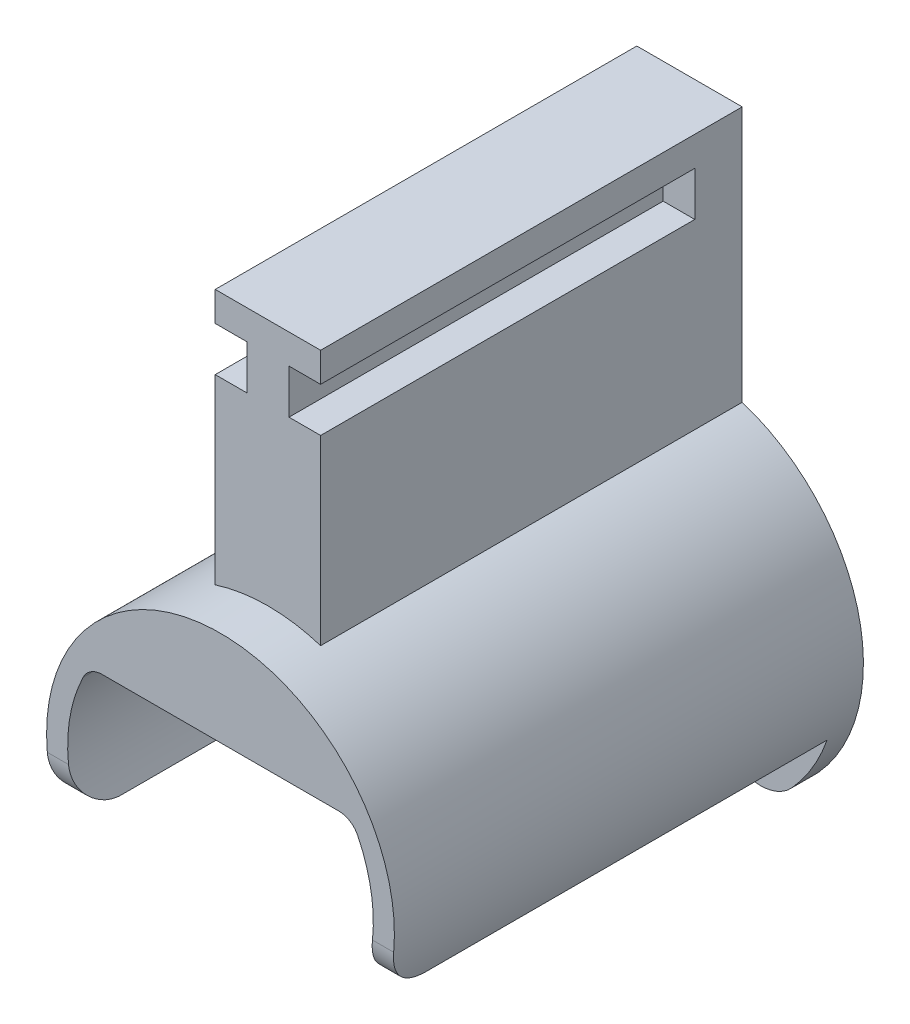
SolidWorks part; units mm, degrees
ref_plane "Front Plane" through (0, 0, 0) normal (0, 0, 1) x (1, 0, 0)
ref_plane "Top Plane" through (0, 0, 0) normal (0, 1, 0) x (1, 0, 0)
ref_plane "Right Plane" through (0, 0, 0) normal (1, 0, 0) x (0, 0, -1)
sketch "Sketch2" plane through (0, 0, 0) normal (0, 0, 1) x (1, 0, 0)
  circle A0 centre (0, 0) radius 5.25
  circle A1 centre (0, 0) radius 16.5
  dimension "D1" = 33
  dimension "D2" = 10.5
extrude "Boss-Extrude1" add sketch "Sketch2" along normal blind 2.5
sketch "Sketch3" plane through (0, 0, 2.5) normal (0, 0, 1) x (1, 0, 0)
  circle A0 centre (0, 0) radius 16.5
  circle A1 centre (0, 0) radius 14.5
  circle A2 centre (0, 0) radius 16.5 construction
  dimension "D1" = 2
extrude "Boss-Extrude2" add sketch "Sketch3" along normal blind 42
sketch "Sketch4" plane through (0, 0, 44.5) normal (0, 0, 1) x (1, 0, 0)
  line L0 (-14.6969, 7.5) -> (14.6969, 7.5)
  line L1 (0, 16.5) -> (17.7782, 16.5) construction
  circle A0 centre (0, 0) radius 16.5 construction
  arc A1 (14.6969, 7.5) -> (-14.6969, 7.5) centre (0, 0) ccw
  dimension "D1" = 9
extrude "Boss-Extrude3" add sketch "Sketch4" against normal blind 2.5
sketch "Sketch5" plane through (0, 0, 44.5) normal (0, 0, 1) x (1, 0, 0)
  line L0 (-15.5563, -5.5) -> (15.5563, -5.5)
  line L1 (0, -16.5) -> (-16.9039, -16.5) construction
  circle A0 centre (0, 0) radius 16.5 construction
  arc A1 (-15.5563, -5.5) -> (15.5563, -5.5) centre (0, 0) ccw
  dimension "D1" = 11
extrude "Cut-Extrude1" cut sketch "Sketch5" against normal up to surface (42 mm away)
sketch "Sketch6" plane through (0, 0, 2.5) normal (0, 0, 1) x (1, 0, 0)
  line L0 (-5.25, 0) -> (-5.25, -15.6425)
  line L1 (5.25, 0) -> (5.25, -15.6425)
  line L2 (-5.25, 0) -> (5.25, 0) construction
  circle A0 centre (0, 0) radius 5.25 construction
  arc A1 (-15.5563, -5.5) -> (15.5563, -5.5) centre (0, 0) ccw construction
  arc A2 (-5.25, 0) -> (5.25, 0) centre (0, 0) ccw
  arc A3 (-5.25, -15.6425) -> (5.25, -15.6425) centre (0, 0) ccw
extrude "Cut-Extrude2" cut sketch "Sketch6" against normal up to next
fillet "Fillet1" radius 4 4 edges at (14.4864, -5.5, 44.5) (-14.4864, -5.5, 44.5) (-5.25, -15.6425, 1.25) (5.25, -15.6425, 1.25)
fillet "Fillet2" radius 2 2 edges at (-12.4097, 7.5, 43.25) (12.4097, 7.5, 43.25)
fillet "Fillet3" radius 1 1 edges at (0, 14.5, 2.5)
sketch "Sketch7" plane through (0, 0, 0) normal (0, 0, 1) x (1, 0, 0)
  line L0 (0, 0) -> (0, 25.5396) construction
  line L1 (-5, 40) -> (5, 40)
  line L2 (-5, 40) -> (-5, 15.7242)
  line L3 (5, 40) -> (5, 15.7242)
  arc A0 (16.4317, -1.5) -> (-16.4317, -1.5) centre (0, 0) ccw construction
  arc A1 (5, 15.7242) -> (-5, 15.7242) centre (0, 0) ccw
  dimension "D1" = 10
  dimension "D2" = 40
extrude "Boss-Extrude4" add sketch "Sketch7" along normal up to surface (44.5 mm away)
sketch "Sketch9" plane through (-5, 0, 0) normal (-1, 0, 0) x (0, 0, 1)
  line L0 (44.5, 40) -> (0, 40) construction
  line L1 (44.5, 40) -> (44.5, 15.7242) construction
  line L3 (4.5, 37.2) -> (44.5, 37.2)
  line L4 (4.5, 37.2) -> (4.5, 33)
  line L5 (4.5, 33) -> (44.5, 33)
  line L6 (44.5, 37.2) -> (44.5, 33)
  dimension "D1" = 4.2
  dimension "D2" = 40
  dimension "D3" = 2.8
extrude "Cut-Extrude3" cut sketch "Sketch9" against normal blind 3
mirror "Mirror1" about plane through (0, 0, 0) normal (1, 0, 0) of "Cut-Extrude3"
sketch "Sketch10" plane through (0, 0, 44.5) normal (0, 0, 1) x (1, 0, 0)
  line L1 (-5, 40) -> (5, 40)
  line L2 (-5, 40) -> (-5, 15.7242)
  line L4 (5, 40) -> (5, 15.7242)
  arc A0 (5, 15.7242) -> (-5, 15.7242) centre (0, 0) ccw
extrude "Cut-Extrude4" cut sketch "Sketch10" against normal blind 4.5
sketch "Sketch11" plane through (0, 0, 0) normal (0, 0, -1) x (-1, 0, 0)
  line L0 (-24.8106, 0) -> (27.5243, 0) construction
  line L1 (0, 14.8041) -> (0, -13.573) construction
  circle A0 centre (-8, 0) radius 1.5
  circle A1 centre (8, 0) radius 1.5
  dimension "D1" = 3
  dimension "D2" = 8
extrude "Cut-Extrude5" cut sketch "Sketch11" against normal up to next
fillet "Fillet5" radius 1 1 edges at (0, 14.5, 42)
chamfer "Chamfer1" distance 1 angle 45 2 edges at (-6.5, 0, 0) (6.5, 0, 0)
